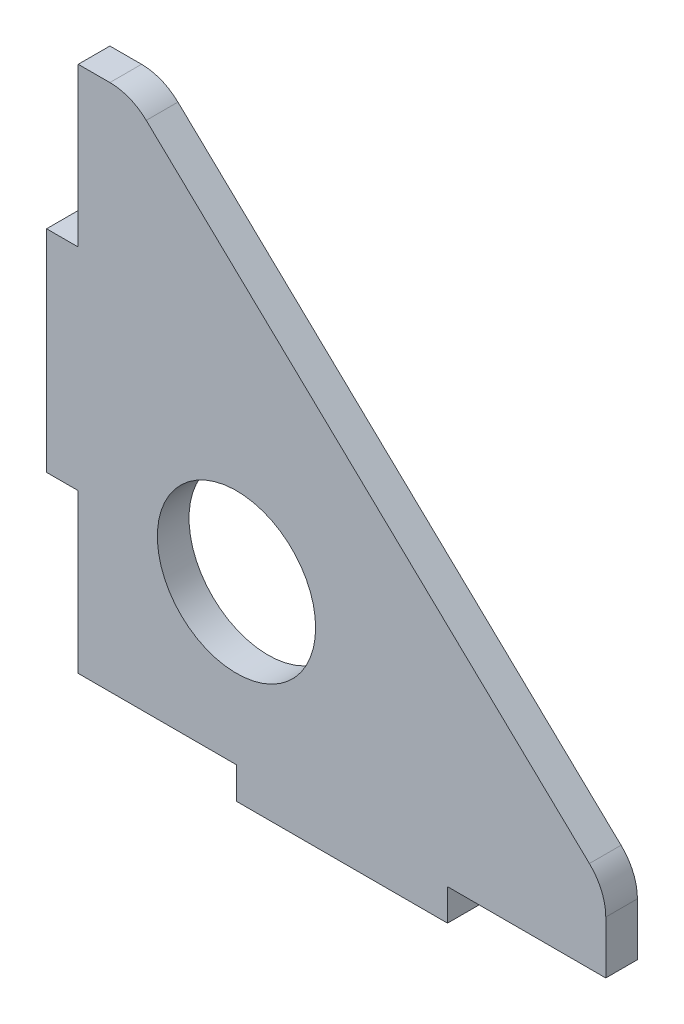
SolidWorks part; units mm, degrees
ref_plane "Plan de face" through (0, 0, 0) normal (0, 0, 1) x (1, 0, 0)
ref_plane "Plan de dessus" through (0, 0, 0) normal (0, 1, 0) x (1, 0, 0)
ref_plane "Plan de droite" through (0, 0, 0) normal (1, 0, 0) x (0, 0, -1)
sketch "Esquisse1" plane through (0, 0, 0) normal (0, 0, 1) x (1, 0, 0)
  line L0 (0, 0) -> (0, 15)
  line L1 (0, 15) -> (-3, 15)
  line L2 (-3, 15) -> (-3, 35)
  line L3 (-3, 35) -> (0, 35)
  line L4 (0, 35) -> (0, 50)
  line L6 (50, 0) -> (35, 0)
  line L7 (0, 50) -> (3, 50)
  line L8 (6.4483, 48.6207) -> (48.4483, 8.6207)
  line L9 (50, 5) -> (50, 0)
  line L10 (15, 0) -> (15, -3)
  line L11 (15, -3) -> (35, -3)
  line L12 (35, -3) -> (35, 0)
  line L13 (15, 0) -> (0, 0)
  line L14 (15, 0) -> (15, 15) construction
  line L15 (0, 15) -> (15, 15) construction
  arc A0 (48.4483, 8.6207) -> (50, 5) centre (45, 5) cw
  arc A1 (3, 50) -> (6.4483, 48.6207) centre (3, 45) cw
  circle A2 centre (15, 15) radius 7.5
  point P14 (5, 50)
  dimension "D6" = 5
  dimension "D9" = 5
  dimension "D1" = 15
  dimension "D2" = 15
  dimension "D3" = 20
  dimension "D4" = 3
  dimension "D5" = 50
  dimension "D7" = 5
  dimension "D8" = 5
  dimension "D10" = 15
  dimension "D11" = 15
  dimension "D12" = 3
extrude "Boss.-Extru.1" add sketch "Esquisse1" along normal blind 3
